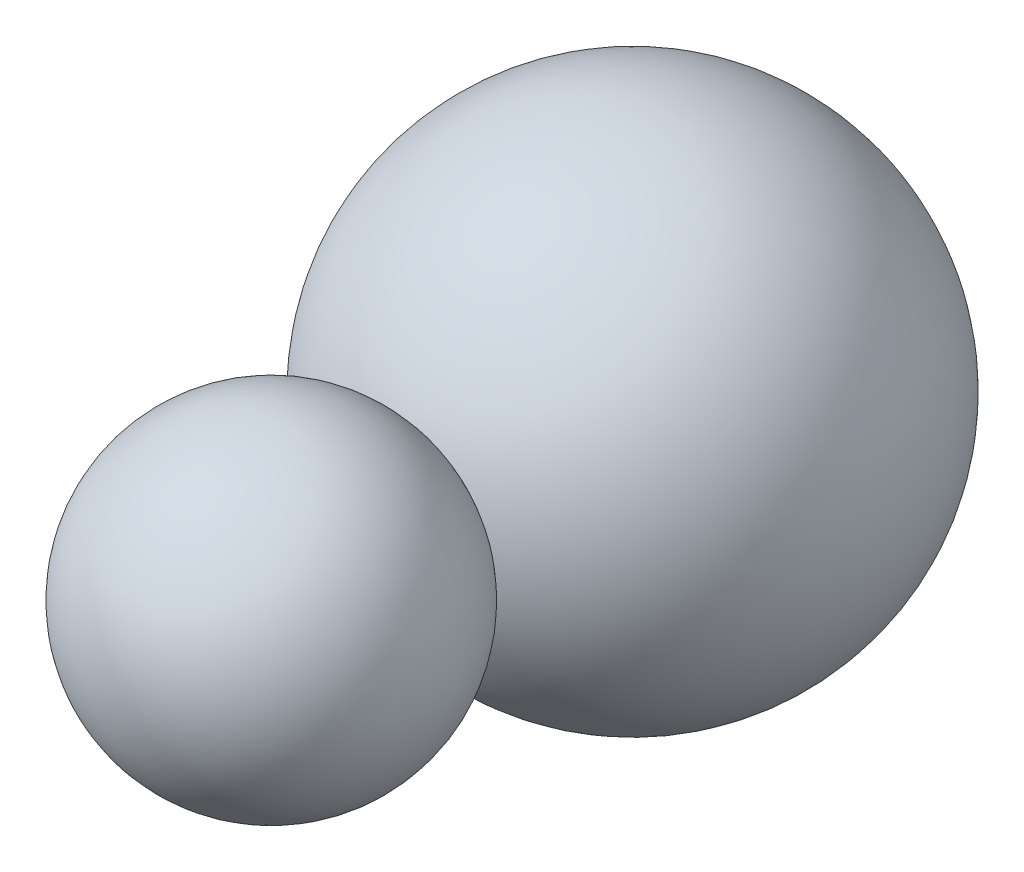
SolidWorks part; units mm, degrees
ref_plane "Front Plane" through (0, 0, 0) normal (0, 0, 1) x (1, 0, 0)
ref_plane "Top Plane" through (0, 0, 0) normal (0, 1, 0) x (1, 0, 0)
ref_plane "Right Plane" through (0, 0, 0) normal (1, 0, 0) x (0, 0, -1)
sketch "Sketch1" plane through (0, 0, 0) normal (0, 0, 1) x (1, 0, 0)
  line L0 (0, 23) -> (0, -23)
  arc A0 (0, -23) -> (0, 23) centre (0, 0) ccw
revolve "Revolve1" add sketch "Sketch1" angle 360 about L0
sketch "Sketch2" plane through (0, 0, 0) normal (0, 0, 1) x (1, 0, 0)
  circle A0 centre (0, 0) radius 4
extrude "Cut-Extrude1" cut sketch "Sketch2" against normal blind 30
sketch "Sketch4" plane through (0, 0, 0) normal (0, 1, 0) x (1, 0, 0)
  line L0 (0, -21.7778) -> (0, 21.7778) construction
  line L1 (0, -19) -> (0, -49)
  arc A0 (0, -49) -> (0, -19) centre (0, -34) ccw
  dimension "D1" = 34
revolve "Revolve2" add sketch "Sketch4" angle 360 about L1
